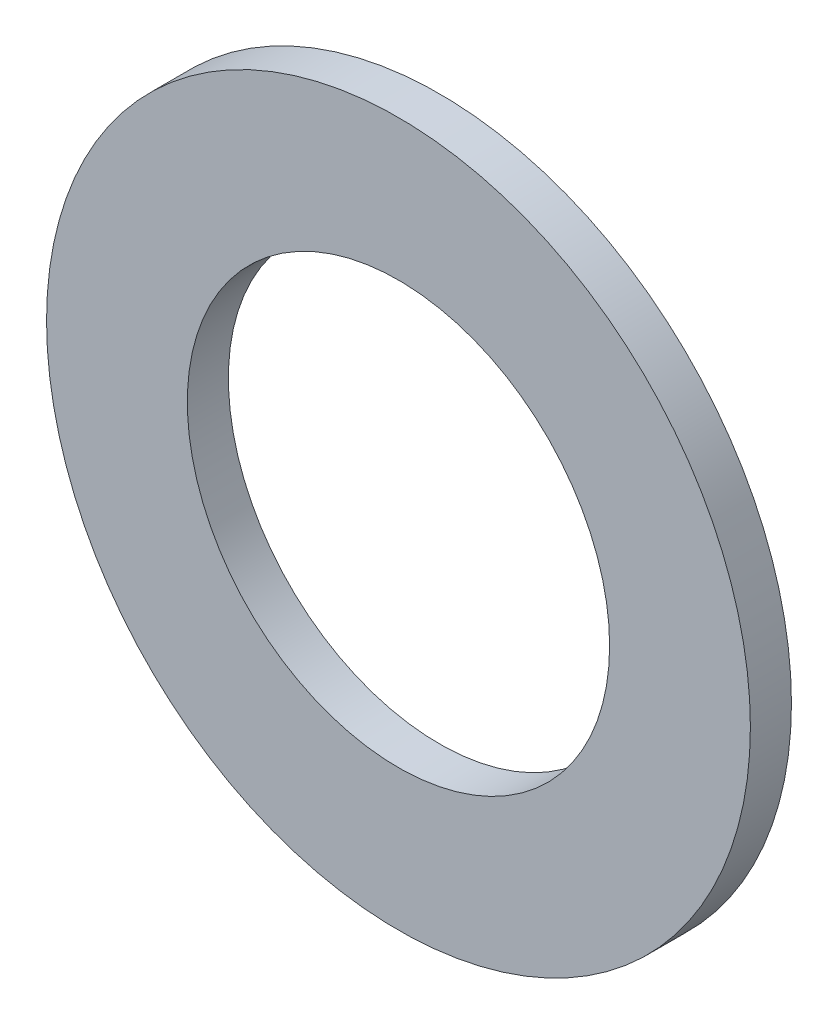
SolidWorks part; units mm, degrees
ref_plane "Plan1" through (0, 0, 0) normal (0, 0, 1) x (1, 0, 0)
ref_plane "Plan2" through (0, 0, 0) normal (0, 1, 0) x (1, 0, 0)
ref_plane "Plan3" through (0, 0, 0) normal (1, 0, 0) x (0, 0, -1)
sketch "Esquisse1" plane through (0, 0, 0) normal (0, 0, 1) x (1, 0, 0)
  circle A0 centre (0, 0) radius 3.6
  circle A1 centre (0, 0) radius 6
  dimension "D1" = 7.2
  dimension "D2" = 12
extrude "Base-Extrusion" add sketch "Esquisse1" along normal mid plane 0.7
